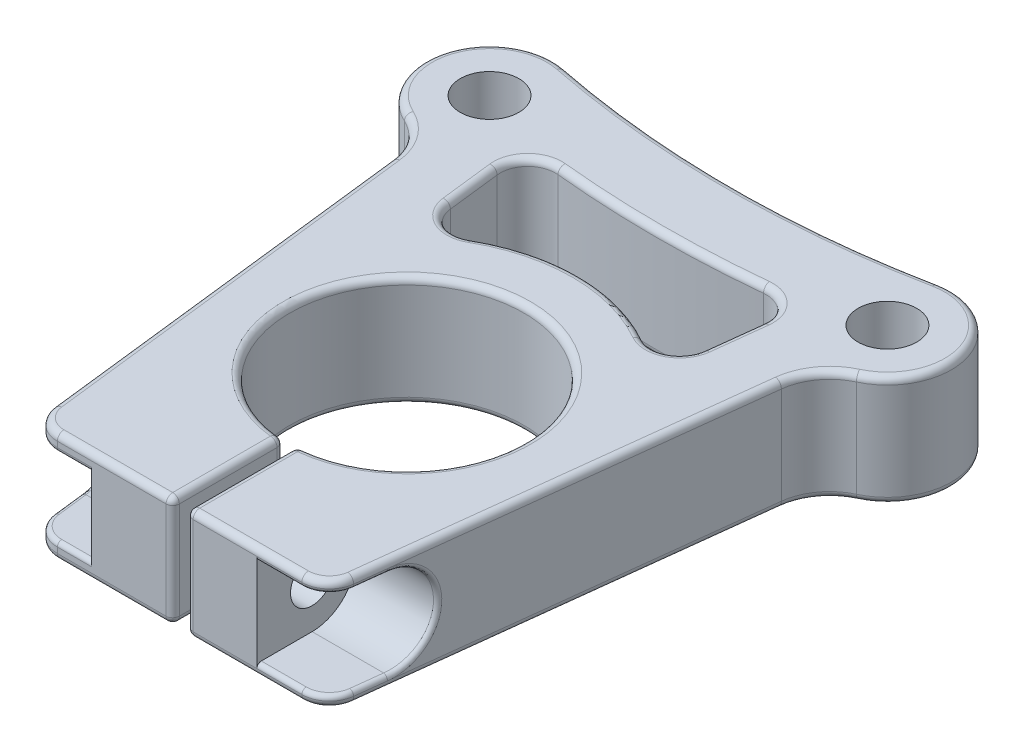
SolidWorks part; units mm, degrees
ref_plane "Front Plane" through (0, 0, 0) normal (0, 0, 1) x (1, 0, 0)
ref_plane "Top Plane" through (0, 0, 0) normal (0, 1, 0) x (1, 0, 0)
ref_plane "Right Plane" through (0, 0, 0) normal (1, 0, 0) x (0, 0, -1)
sketch "Sketch1" plane through (0, 0, 0) normal (0, 1, 0) x (1, 0, 0)
  line L0 (0, 153.3163) -> (0, 236.0783) construction
  line L1 (-22.8811, 185.7013) -> (22.8811, 185.7013) construction
  line L2 (-15.2849, 178.9838) -> (-14.5713, 172.8974)
  line L3 (-0.7937, 139.8777) -> (-0.7937, 127.1777)
  line L4 (-22.3741, 174.0113) -> (-17.212, 129.983)
  line L5 (0, 300.7322) -> (-22.8811, 185.7013) construction
  line L6 (15.2849, 178.9838) -> (14.5713, 172.8974)
  line L7 (0, 300.7322) -> (22.8811, 185.7013) construction
  line L8 (-0.7937, 127.1777) -> (-14.0586, 127.1777)
  line L9 (22.3741, 174.0113) -> (17.212, 129.983)
  line L10 (0.7937, 127.1777) -> (14.0586, 127.1777)
  line L11 (0.7937, 139.8777) -> (0.7937, 127.1777)
  arc A0 (0.7937, 139.8777) -> (-0.7937, 139.8777) centre (0, 153.3163) ccw
  circle A1 centre (-22.8811, 185.7013) radius 3.3734
  circle A2 centre (22.8811, 185.7013) radius 3.3734
  arc A3 (22.3741, 174.0113) -> (25.9958, 179.0263) centre (28.6809, 173.2719) cw
  arc A4 (-25.9958, 179.0263) -> (-21.444, 192.9258) centre (-22.8811, 185.7013) cw
  arc A5 (25.9958, 179.0263) -> (21.444, 192.9258) centre (22.8811, 185.7013) ccw
  circle A6 centre (0, 300.7322) radius 117.2845 construction
  arc A7 (21.444, 192.9258) -> (-21.444, 192.9258) centre (0, 300.7322) cw
  arc A8 (-22.3741, 174.0113) -> (-25.9958, 179.0263) centre (-28.6809, 173.2719) ccw
  arc A9 (-14.0586, 127.1777) -> (-17.212, 129.983) centre (-14.0586, 130.3527) cw
  circle A10 centre (0, 300.7322) radius 117.2845 construction
  arc A11 (14.0586, 127.1777) -> (17.212, 129.983) centre (14.0586, 130.3527) ccw
  arc A12 (-9.8408, 170.5115) -> (9.8408, 170.5115) centre (0, 153.3163) cw
  arc A13 (-11.8157, 182.5127) -> (11.8157, 182.5127) centre (0, 300.7322) ccw
  arc A14 (-15.2849, 178.9838) -> (-11.8157, 182.5127) centre (-12.1315, 179.3535) cw
  arc A15 (15.2849, 178.9838) -> (11.8157, 182.5127) centre (12.1315, 179.3535) ccw
  arc A16 (14.5713, 172.8974) -> (9.8408, 170.5115) centre (11.4179, 173.2671) cw
  arc A17 (-14.5713, 172.8974) -> (-9.8408, 170.5115) centre (-11.4179, 173.2671) ccw
  point P20 (-16.8831, 127.1777)
  point P29 (-8.4137, 116.9386)
  point P34 (22.8811, 178.3353)
  point P39 (-22.8811, 178.3353)
  point P42 (-15.7526, 182.9727)
  point P45 (15.7526, 182.9727)
  point P48 (13.9275, 167.4067)
  point P51 (-13.9275, 167.4067)
  dimension "D2" = 26.924
  dimension "D3" = 6.35
  dimension "D4" = 32.385
  dimension "D6" = 22.5
  dimension "D8" = 1.5875
  dimension "D5" = 6.7469
  dimension "D7" = 7.366
  dimension "D9" = 3.175
  dimension "D10" = 12.7
  dimension "D11" = 6.35
  dimension "D13" = 6.35
  dimension "D14" = 8.89
  dimension "D15" = 3.175
  dimension "D12" = 7.62
extrude "Boss-Extrude1" add sketch "Sketch1" along normal mid plane 12.7
ref_plane "Plane1" through (-22.86, 0, 0) normal (1, 0, 0) x (0, 0, -1)
hole_wizard "#9 (0.196) Diameter Hole1" positions "Sketch4" profile "Sketch3" hole size "#9" standard "ANSI Inch"
sketch "Sketch4" plane through (-22.86, 0, 0) normal (1, 0, 0) x (0, 0, -1)
  line L0 (127.1777, 6.35) -> (127.1777, -6.35) construction
  point P0 (133.5277, 0)
  point P3 (133.5277, 0)
  dimension "D1" = 6.35
sketch "Sketch3" plane through (-22.86, 0, -133.5277) normal (0, 1, 0) x (0, 0, 1)
  line L0 (0, 0) -> (0, 53.1071)
  line L1 (0, 53.1071) -> (2.4892, 53.1071)
  line L2 (2.4892, 53.1071) -> (2.4892, 0)
  line L5 (2.4892, 0) -> (0, 0)
  line L11 (0, -6.35) -> (0, 107.95) construction
  dimension "Thru Hole Dia." = 4.9784
  dimension "Thru Hole Depth" = 53.1071
sketch "Sketch6" plane through (-22.86, 0, 0) normal (1, 0, 0) x (0, 0, -1)
  line L0 (133.5277, 4.445) -> (127.1777, 4.445)
  line L1 (127.1777, 6.35) -> (127.1777, -6.35) construction
  line L2 (133.5277, -4.445) -> (127.1777, -4.445)
  line L3 (127.1777, -4.445) -> (127.1777, 4.445)
  arc A0 (133.5277, -4.445) -> (133.5277, 4.445) centre (133.5277, 0) ccw
  dimension "D1" = 8.89
extrude "Cut-Extrude3" cut sketch "Sketch6" along normal blind 12.7
ref_plane "Plane2" through (22.86, 0, 0) normal (1, 0, 0) x (0, 0, -1)
sketch "Sketch5" plane through (22.86, 0, 0) normal (1, 0, 0) x (0, 0, -1)
  line L0 (133.5277, 5.08) -> (127.1777, 5.08)
  line L1 (127.1777, 6.35) -> (127.1777, -6.35) construction
  line L2 (127.1777, 5.08) -> (127.1777, -5.08)
  line L3 (127.1777, -5.08) -> (133.5277, -5.08)
  arc A0 (133.5277, -5.08) -> (133.5277, 5.08) centre (133.5277, 0) ccw
  circle A2 centre (133.5277, 0) radius 2.4892 construction
  dimension "D1" = 10.16
extrude "Cut-Extrude1" cut sketch "Sketch5" against normal blind 13.97
fillet "Fillet1" radius 0.762 48 edges at (12.8477, -6.35, -170.4323) (0, -6.35, -173.1283) (-12.8477, -6.35, -170.4323) (-14.9281, -6.35, -175.9406) (-14.3957, -6.35, -181.5793) (0, -6.35, -181.9237) (14.3957, -6.35, -181.5793) (7.4262, -6.35, -127.1777) (16.1689, -6.35, -127.9806) (19.793, -6.35, -151.9972) (23.533, -6.35, -176.9896) (-7.4262, -6.35, -127.1777) (-16.1689, -6.35, -127.9806) (-19.793, -6.35, -151.9972) (-23.533, -6.35, -176.9896) (-29.8813, -6.35, -187.9937) (0, -6.35, -190.8137) (-14.3957, 6.35, -181.5793) (0, 6.35, -181.9237) (14.3957, 6.35, -181.5793) (14.9281, 6.35, -175.9406) (12.8477, 6.35, -170.4323) (0, 6.35, -173.1283) (-12.8477, 6.35, -170.4323) (7.4262, 6.35, -127.1777) (16.1689, 6.35, -127.9806) (-7.4262, 6.35, -127.1777) (-16.1689, 6.35, -127.9806) (-19.793, 6.35, -151.9972) (-23.533, 6.35, -176.9896) (-29.8813, 6.35, -187.9937) (0, 6.35, -190.8137) (29.8813, 6.35, -187.9937) (23.533, 6.35, -176.9896) (0.7937, 0, -127.1777) (-0.7937, 0, -139.8777) (0.7937, 0, -139.8777) (-0.7937, 0, -127.1777) (0.7937, -6.35, -133.5277) (-0.7937, -6.35, -133.5277) (0, -6.35, -166.7783) (14.9281, -6.35, -175.9406) (29.8813, -6.35, -187.9937) (-14.9281, 6.35, -175.9406) (-0.7937, 6.35, -133.5277) (0.7937, 6.35, -133.5277) (0, 6.35, -166.7783) (19.793, 6.35, -151.9972)
fillet "Fillet2" radius 0.508 14 edges at (11.4743, 5.08, -127.1777) (16.1689, 5.08, -127.9806) (17.4198, 5.08, -131.7554) (11.4743, -5.08, -127.1777) (16.1689, -5.08, -127.9806) (17.4198, -5.08, -131.7554) (-12.1093, 4.445, -127.1777) (-16.1689, 4.445, -127.9806) (-17.4198, 4.445, -131.7554) (-12.1093, -4.445, -127.1777) (-16.1689, -4.445, -127.9806) (-17.4198, -4.445, -131.7554) (18.2232, 0, -138.6077) (-18.1487, 0, -137.9727)
